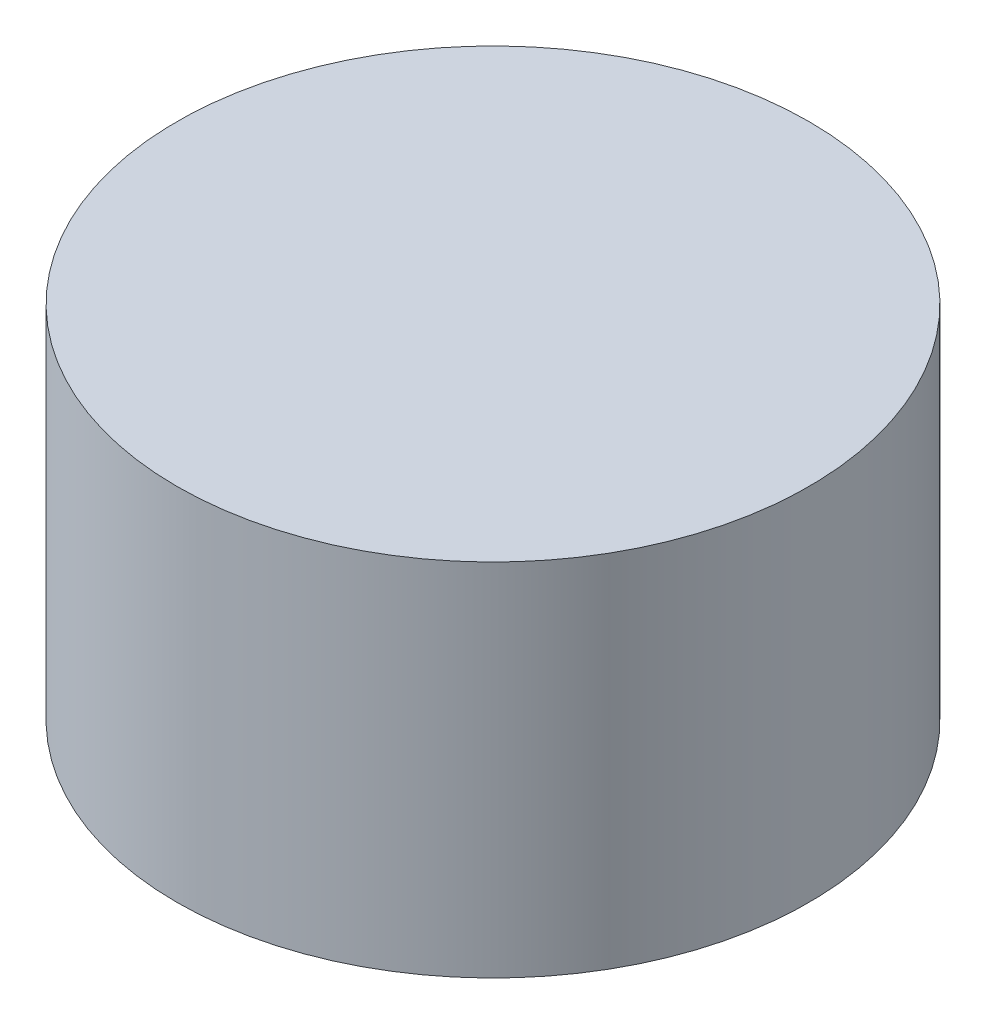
SolidWorks part; units mm, degrees
ref_plane "Front Plane" through (0, 0, 0) normal (0, 0, 1) x (1, 0, 0)
ref_plane "Top Plane" through (0, 0, 0) normal (0, 1, 0) x (1, 0, 0)
ref_plane "Right Plane" through (0, 0, 0) normal (1, 0, 0) x (0, 0, -1)
sketch "Sketch1" plane through (0, 0, 0) normal (0, 1, 0) x (1, 0, 0)
  circle A0 centre (0, 0) radius 12.5
  circle A1 centre (0, 0) radius 3
extrude "Boss-Extrude1" add sketch "Sketch1" along normal blind 13.25
sketch "Sketch2" plane through (0, 13.25, 0) normal (0, 1, 0) x (1, 0, 0)
  circle A0 centre (0, 0) radius 12.5
extrude "Boss-Extrude2" add sketch "Sketch2" along normal blind 1
sketch "Sketch3" plane through (0, 0, 0) normal (0, -1, 0) x (-1, 0, 0)
  circle A0 centre (0, 0) radius 7
extrude "Cut-Extrude1" cut sketch "Sketch3" against normal blind 6.75
